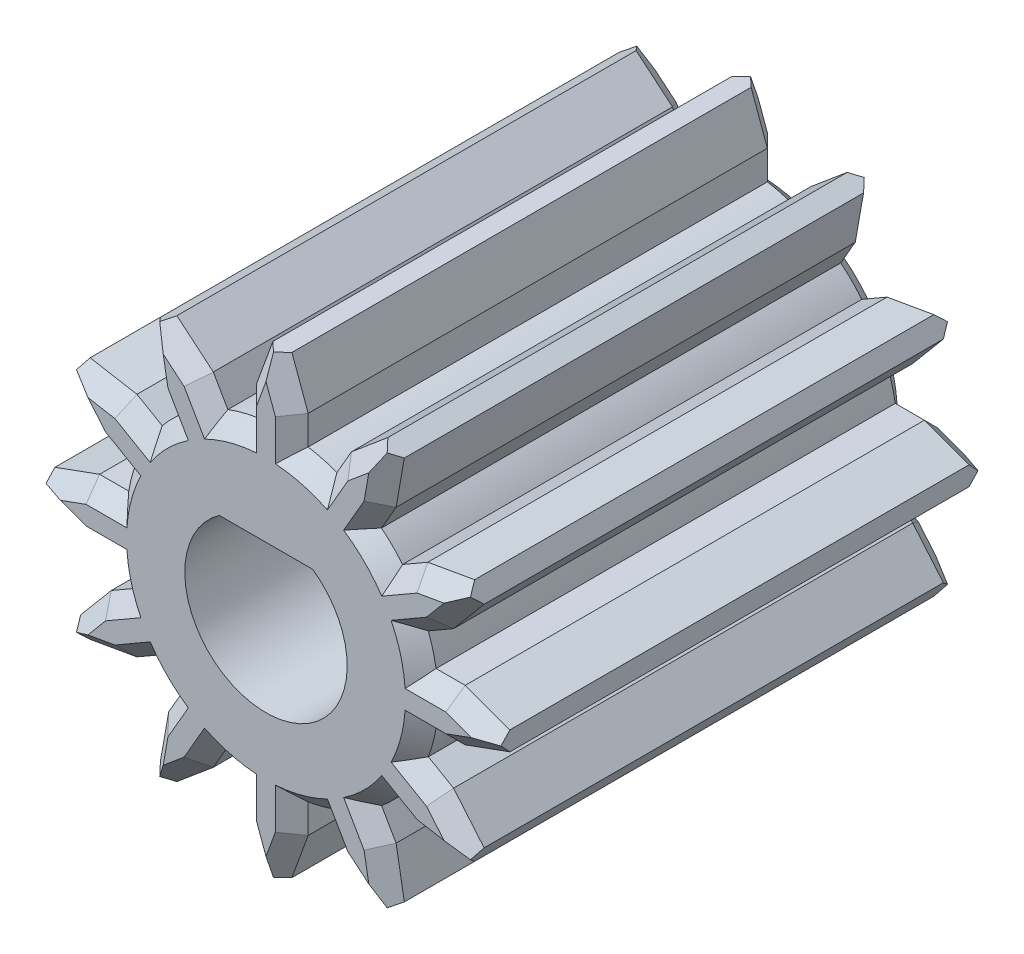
SolidWorks part; units mm, degrees
ref_plane "Piano frontale" through (0, 0, 0) normal (0, 0, 1) x (1, 0, 0)
ref_plane "Piano superiore" through (0, 0, 0) normal (0, 1, 0) x (1, 0, 0)
ref_plane "Piano destro" through (0, 0, 0) normal (1, 0, 0) x (0, 0, -1)
sketch "Schizzo1" plane through (0, 0, 0) normal (0, 0, 1) x (1, 0, 0)
  line L0 (-0.7855, 4.6846) -> (-0.7855, 5.5726)
  line L1 (-0.7855, 5.5726) -> (-0.2898, 6.9346)
  line L2 (-0.2898, 6.9346) -> (0.2898, 6.9346)
  line L3 (0.2898, 6.9346) -> (0.7855, 5.5726)
  line L4 (0.7855, 5.5726) -> (0.7855, 4.6846)
  line L5 (0, -8.4939) -> (0, 8.1917) construction
  line L6 (2.106, 5.2188) -> (3.2164, 6.1504)
  line L7 (1.662, 4.4497) -> (2.106, 5.2188)
  line L8 (3.7183, 5.8607) -> (3.4666, 4.4333)
  line L9 (3.4666, 4.4333) -> (3.0226, 3.6642)
  line L10 (3.2164, 6.1504) -> (3.7183, 5.8607)
  line L11 (4.4333, 3.4666) -> (5.8607, 3.7183)
  line L12 (3.6642, 3.0226) -> (4.4333, 3.4666)
  line L13 (6.1504, 3.2164) -> (5.2188, 2.106)
  line L14 (5.2188, 2.106) -> (4.4497, 1.662)
  line L15 (5.8607, 3.7183) -> (6.1504, 3.2164)
  line L16 (5.5726, 0.7855) -> (6.9346, 0.2898)
  line L17 (4.6846, 0.7855) -> (5.5726, 0.7855)
  line L18 (6.9346, -0.2898) -> (5.5726, -0.7855)
  line L19 (5.5726, -0.7855) -> (4.6846, -0.7855)
  line L20 (6.9346, 0.2898) -> (6.9346, -0.2898)
  line L21 (5.2188, -2.106) -> (6.1504, -3.2164)
  line L22 (4.4497, -1.662) -> (5.2188, -2.106)
  line L23 (5.8607, -3.7183) -> (4.4333, -3.4666)
  line L24 (4.4333, -3.4666) -> (3.6642, -3.0226)
  line L25 (6.1504, -3.2164) -> (5.8607, -3.7183)
  line L26 (3.4666, -4.4333) -> (3.7183, -5.8607)
  line L27 (3.0226, -3.6642) -> (3.4666, -4.4333)
  line L28 (3.2164, -6.1504) -> (2.106, -5.2188)
  line L29 (2.106, -5.2188) -> (1.662, -4.4497)
  line L30 (3.7183, -5.8607) -> (3.2164, -6.1504)
  line L31 (0.7855, -5.5726) -> (0.2898, -6.9346)
  line L32 (0.7855, -4.6846) -> (0.7855, -5.5726)
  line L33 (-0.2898, -6.9346) -> (-0.7855, -5.5726)
  line L34 (-0.7855, -5.5726) -> (-0.7855, -4.6846)
  line L35 (0.2898, -6.9346) -> (-0.2898, -6.9346)
  line L36 (-2.106, -5.2188) -> (-3.2164, -6.1504)
  line L37 (-1.662, -4.4497) -> (-2.106, -5.2188)
  line L38 (-3.7183, -5.8607) -> (-3.4666, -4.4333)
  line L39 (-3.4666, -4.4333) -> (-3.0226, -3.6642)
  line L40 (-3.2164, -6.1504) -> (-3.7183, -5.8607)
  line L41 (-4.4333, -3.4666) -> (-5.8607, -3.7183)
  line L42 (-3.6642, -3.0226) -> (-4.4333, -3.4666)
  line L43 (-6.1504, -3.2164) -> (-5.2188, -2.106)
  line L44 (-5.2188, -2.106) -> (-4.4497, -1.662)
  line L45 (-5.8607, -3.7183) -> (-6.1504, -3.2164)
  line L46 (-5.5726, -0.7855) -> (-6.9346, -0.2898)
  line L47 (-4.6846, -0.7855) -> (-5.5726, -0.7855)
  line L48 (-6.9346, 0.2898) -> (-5.5726, 0.7855)
  line L49 (-5.5726, 0.7855) -> (-4.6846, 0.7855)
  line L50 (-6.9346, -0.2898) -> (-6.9346, 0.2898)
  line L51 (-5.2188, 2.106) -> (-6.1504, 3.2164)
  line L52 (-4.4497, 1.662) -> (-5.2188, 2.106)
  line L53 (-5.8607, 3.7183) -> (-4.4333, 3.4666)
  line L54 (-4.4333, 3.4666) -> (-3.6642, 3.0226)
  line L55 (-6.1504, 3.2164) -> (-5.8607, 3.7183)
  line L56 (-3.4666, 4.4333) -> (-3.7183, 5.8607)
  line L57 (-3.0226, 3.6642) -> (-3.4666, 4.4333)
  line L58 (-3.2164, 6.1504) -> (-2.106, 5.2188)
  line L59 (-2.106, 5.2188) -> (-1.662, 4.4497)
  line L60 (-3.7183, 5.8607) -> (-3.2164, 6.1504)
  circle A0 centre (0, 0) radius 4.75
  point P79 (0, 0)
  dimension "D2" = 9.5
  dimension "D1" = 20
  dimension "D3" = 2.25
  dimension "D4" = 1.571
  dimension "D5" = 1.362
  dimension "D6" = 12
extrude "Estrusione-Estrusione1" add sketch "Schizzo1" along normal blind 15 contours A0 L5 | L5 A0 | L5 A0 L4 L3 L2 | A0 L5 L2 L1 L0 | A0 L59 L58 L60 L56 L57 | A0 L54 L53 L55 L51 L52 | A0 L49 L48 L50 L46 L47 | A0 L44 L43 L45 L41 L42 | A0 L39 L38 L40 L36 L37 | L5 L35 L31 L32 A0 | L35 L5 A0 L34 L33 | A0 L29 L28 L30 L26 L27 | A0 L24 L23 L25 L21 L22 | A0 L19 L18 L20 L16 L17 | A0 L14 L13 L15 L11 L12 | A0 L9 L8 L10 L6 L7
chamfer "Smusso1" distance 0.5 angle 45 144 edges at (0.7855, 5.1286, 0) (0.7855, 5.1286, 15) (1.2294, 4.5881, 15) (1.2294, 4.5881, 0) (1.884, 4.8342, 0) (1.884, 4.8342, 15) (2.6612, 5.6846, 0) (2.6612, 5.6846, 15) (3.5924, 5.147, 0) (3.5924, 5.147, 15) (3.2446, 4.0487, 0) (3.2446, 4.0487, 15) (3.3588, 3.3588, 15) (3.3588, 3.3588, 0) (4.0487, 3.2446, 0) (4.0487, 3.2446, 15) (5.147, 3.5924, 0) (5.147, 3.5924, 15) (5.6846, 2.6612, 0) (5.6846, 2.6612, 15) (4.8342, 1.884, 0) (4.8342, 1.884, 15) (4.5881, 1.2294, 15) (4.5881, 1.2294, 0) (5.1286, 0.7855, 0) (5.1286, 0.7855, 15) (6.2536, 0.5376, 0) (6.2536, 0.5376, 15) (6.2536, -0.5376, 0) (6.2536, -0.5376, 15) (5.1286, -0.7855, 0) (5.1286, -0.7855, 15) (4.5881, -1.2294, 15) (4.5881, -1.2294, 0) (4.8342, -1.884, 0) (4.8342, -1.884, 15) (5.6846, -2.6612, 0) (5.6846, -2.6612, 15) (5.147, -3.5924, 0) (5.147, -3.5924, 15) (4.0487, -3.2446, 0) (4.0487, -3.2446, 15) (3.3588, -3.3588, 15) (3.3588, -3.3588, 0) (3.2446, -4.0487, 0) (3.2446, -4.0487, 15) (3.5924, -5.147, 0) (3.5924, -5.147, 15) (2.6612, -5.6846, 0) (2.6612, -5.6846, 15) (1.884, -4.8342, 0) (1.884, -4.8342, 15) (1.2294, -4.5881, 15) (1.2294, -4.5881, 0) (0.7855, -5.1286, 0) (0.7855, -5.1286, 15) (0.5376, -6.2536, 0) (0.5376, -6.2536, 15) (-0.5376, -6.2536, 0) (-0.5376, -6.2536, 15) (-0.7855, -5.1286, 0) (-0.7855, -5.1286, 15) (-1.2294, -4.5881, 15) (-1.2294, -4.5881, 0) (-1.884, -4.8342, 0) (-1.884, -4.8342, 15) (-2.6612, -5.6846, 0) (-2.6612, -5.6846, 15) (-3.5924, -5.147, 0) (-3.5924, -5.147, 15) (-3.2446, -4.0487, 0) (-3.2446, -4.0487, 15) (-3.3588, -3.3588, 15) (-3.3588, -3.3588, 0) (-4.0487, -3.2446, 0) (-4.0487, -3.2446, 15) (-5.147, -3.5924, 0) (-5.147, -3.5924, 15) (-5.6846, -2.6612, 0) (-5.6846, -2.6612, 15) (-4.8342, -1.884, 0) (-4.8342, -1.884, 15) (-4.5881, -1.2294, 15) (-4.5881, -1.2294, 0) (-5.1286, -0.7855, 0) (-5.1286, -0.7855, 15) (-6.2536, -0.5376, 0) (-6.2536, -0.5376, 15) (-6.2536, 0.5376, 0) (-6.2536, 0.5376, 15) (-5.1286, 0.7855, 0) (-5.1286, 0.7855, 15) (-4.5881, 1.2294, 15) (-4.5881, 1.2294, 0) (-4.8342, 1.884, 0) (-4.8342, 1.884, 15) (-5.6846, 2.6612, 0) (-5.6846, 2.6612, 15) (-5.147, 3.5924, 0) (-5.147, 3.5924, 15) (-4.0487, 3.2446, 0) (-4.0487, 3.2446, 15) (-3.3588, 3.3588, 15) (-3.3588, 3.3588, 0) (-3.2446, 4.0487, 0) (-3.2446, 4.0487, 15) (-3.5924, 5.147, 0) (-3.5924, 5.147, 15) (-2.6612, 5.6846, 0) (-2.6612, 5.6846, 15) (-1.884, 4.8342, 0) (-1.884, 4.8342, 15) (-1.2294, 4.5881, 15) (-1.2294, 4.5881, 0) (-0.7855, 5.1286, 0) (-0.7855, 5.1286, 15) (-0.5376, 6.2536, 0) (-0.5376, 6.2536, 15) (0.5376, 6.2536, 0) (0.5376, 6.2536, 15) (6.0055, 3.4673, 0) (6.0055, 3.4673, 15) (3.4673, 6.0055, 0) (3.4673, 6.0055, 15) (0, 6.9346, 0) (0, 6.9346, 15) (-3.4673, 6.0055, 0) (-3.4673, 6.0055, 15) (-6.0055, 3.4673, 0) (-6.0055, 3.4673, 15) (-6.9346, 0, 0) (-6.9346, 0, 15) (-6.0055, -3.4673, 0) (-6.0055, -3.4673, 15) (-3.4673, -6.0055, 0) (-3.4673, -6.0055, 15) (0, -6.9346, 0) (0, -6.9346, 15) (3.4673, -6.0055, 0) (3.4673, -6.0055, 15) (6.0055, -3.4673, 0) (6.0055, -3.4673, 15) (6.9346, 0, 0) (6.9346, 0, 15)
sketch "Schizzo2" plane through (0, 0, 15) normal (0, 0, 1) x (1, 0, 0)
  line L0 (-1.423, 2.025) -> (1.423, 2.025)
  circle A0 centre (0, 0) radius 2.475
  dimension "D1" = 4.95
  dimension "D2" = 4.5
extrude "Taglio-Estrusione1" cut sketch "Schizzo2" against normal through all contours L0 A0
sketch "Schizzo3" plane through (0, 0, 15) normal (0, 0, 1) x (1, 0, 0)
  circle A0 centre (0, 0) radius 6 construction
  dimension "D1" = 12
